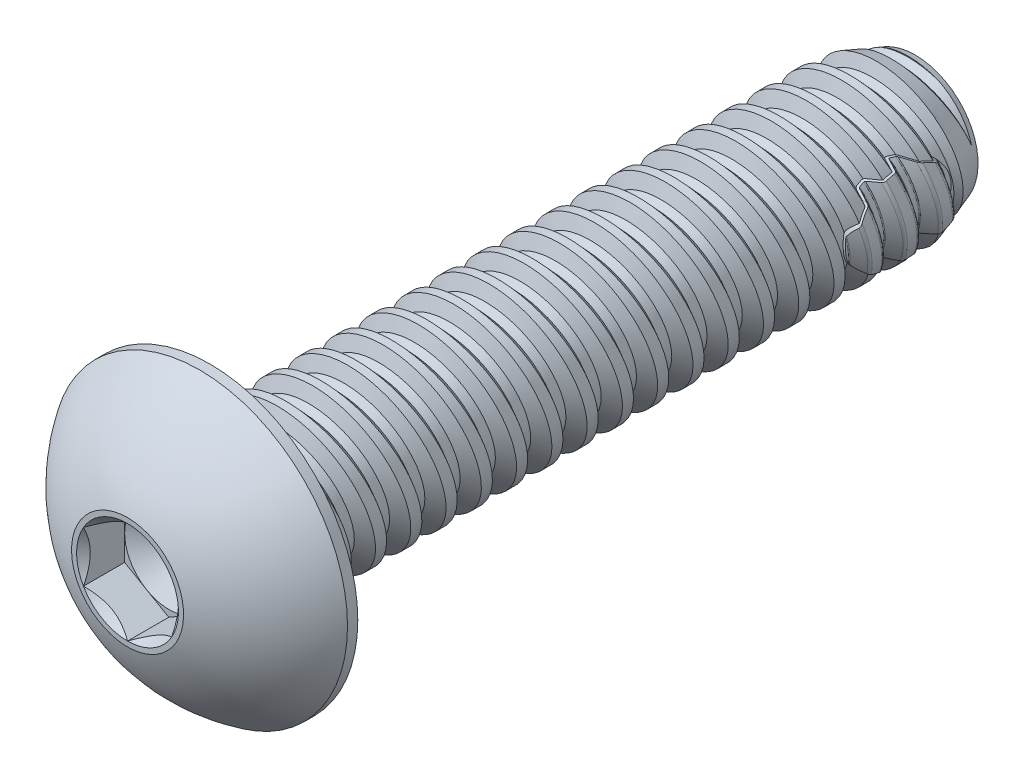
SolidWorks part; units mm, degrees
ref_plane "Front" through (0, 0, 0) normal (0, 0, 1) x (1, 0, 0)
ref_plane "Top" through (0, 0, 0) normal (0, 1, 0) x (1, 0, 0)
ref_plane "Right" through (0, 0, 0) normal (1, 0, 0) x (0, 0, -1)
sketch "Sketch1" plane through (0, 0, 0) normal (1, 0, 0) x (0, 0, -1)
  line L0 (0, 0) -> (-1.8542, 0) construction
  line L1 (0, 0) -> (15.875, 0)
  line L2 (0, 0) -> (0, 1.7526)
  line L3 (0, 1.7526) -> (15.875, 1.7526)
  line L4 (15.875, 0) -> (15.875, 1.7526)
  line L5 (0, -1.7526) -> (15.875, -1.7526) construction
  point P9 (0, 0)
  dimension "D1" = 15.875
  dimension "Thread Dia" = 3.5052
  dimension "Length" = 15.875
  dimension "Head Height" = 1.8542
revolve "Revolve1" add sketch "Sketch1" angle 360 about L0
ref_plane "Plane1" through (0, 0, 1.8542) normal (0, 0, 1) x (1, 0, 0)
sketch "Sketch2" plane through (0, 0, 0) normal (1, 0, 0) x (0, 0, -1)
  line L0 (0, 1.7526) -> (0, -1.7526) construction
  line L1 (0, -1.7526) -> (0.7938, -1.7526) construction
  line L2 (0.7938, -1.7526) -> (0, 1.7526) construction
  line L3 (0, 1.7526) -> (0.0968, 1.7745) construction
  line L4 (0.0968, 1.7745) -> (0.7741, 1.9279)
  line L5 (0.7741, 1.9279) -> (0.6271, 1.4541)
  line L6 (0.6271, 1.4541) -> (0.4336, 1.4103)
  line L7 (0.4336, 1.4103) -> (0.0968, 1.7745)
  line L8 (0.5303, 1.4322) -> (0.4355, 1.8512) construction
  line L9 (0, -1.7526) -> (15.875, -1.7526) construction
  line L10 (0, 1.7526) -> (15.875, 1.7526) construction
  line L12 (0.4578, 1.7526) -> (1.2515, -1.7526) construction
  line L13 (0, -0.1935) -> (1.7093, 0.1935) construction
  line L15 (0, 0) -> (0, 1.7526) construction
  point P19 (0.8547, 0)
  dimension "D1" = 60
  dimension "Thread Pitch" = 0.7937
  dimension "D2" = 0.0992
  dimension "D3" = 0.1984
  dimension "D4" = 0.7937
revolve "Cut-Revolve1" cut sketch "Sketch2" angle 360 about L13
sketch "Sketch3" plane through (0, 0, 0) normal (1, 0, 0) x (0, 0, -1)
  line L0 (15.875, 1.4103) -> (14.9345, 1.7526)
  line L1 (14.9345, 1.7526) -> (15.875, 1.7526)
  line L2 (15.875, 1.7526) -> (15.875, 1.4103)
  line L3 (0, 1.7526) -> (15.875, 1.7526) construction
  line L4 (15.875, 0) -> (15.875, 1.7526) construction
  line L5 (14.9345, 0) -> (0, 0) construction
  line L6 (14.9345, 1.7526) -> (14.9345, -1.7526) construction
  line L7 (0, -1.7526) -> (15.875, -1.7526) construction
  dimension "D1" = 20
  dimension "D2" = 3.5052
revolve "Cut-Revolve2" cut sketch "Sketch3" angle 360 about L5
pattern_linear "LPattern1" count 20 spacing 0.7937 along (0, 0, 1) count 2 spacing 0.7937 along (0, 0, 1)
sketch "Sketch4" plane through (0, 0, 0) normal (0, 0, 1) x (1, 0, 0)
  circle A0 centre (0, 0) radius 3.3274
  dimension "Head Dia" = 6.6548
extrude "Extrude1" add sketch "Sketch4" along normal up to surface (1.8542 mm away)
sketch "Sketch6" plane through (0, 0, 1.8542) normal (0, 0, 1) x (1, 0, 0)
  line L1 (0, -1.1457) -> (0.9922, -0.5728)
  line L2 (0.9922, -0.5728) -> (0.9922, 0.5728)
  line L3 (0.9922, 0.5728) -> (0, 1.1457)
  line L4 (0, 1.1457) -> (-0.9922, 0.5728)
  line L5 (-0.9922, 0.5728) -> (-0.9922, -0.5728)
  line L6 (-0.9922, -0.5728) -> (0, -1.1457)
  circle A0 centre (0, 0) radius 0.9922 construction
  dimension "Hex" = 1.9844
extrude "Cut-Extrude1" cut sketch "Sketch6" against normal blind 0.9271
sketch "Sketch7" plane through (0, 0, 1.8542) normal (0, 0, 1) x (1, 0, 0)
  circle A0 centre (0, 0) radius 1.1457
extrude "Cut-Extrude4" cut sketch "Sketch7" against normal blind 0.9271 draft 45
sketch "Sketch8" plane through (0, 0, 0.9271) normal (0, 0, 1) x (1, 0, 0)
  circle A0 centre (0, 0) radius 0.9922 construction
  circle A1 centre (0, 0) radius 0.9922
extrude "Cut-Extrude5" cut sketch "Sketch8" against normal blind 0.309 draft 60
sketch "Sketch13" plane through (0, 0, 0) normal (1, 0, 0) x (0, 0, -1)
  line L0 (-1.8542, -0.5728) -> (-1.8542, 0.5728) construction
  line L1 (-1.8542, 0.5728) -> (-1.8542, 1.1457) construction
  line L2 (-1.8542, -0.5728) -> (-1.8542, 0.5728) construction
  line L3 (-1.8542, 0.5728) -> (-1.8542, 1.1457) construction
  line L4 (-1.8542, -1.1457) -> (-1.8542, -0.5728) construction
  line L5 (-1.8542, -1.1457) -> (-1.8542, -0.5728) construction
  line L6 (0, -3.3274) -> (0, 3.3274) construction
  line L7 (0, -3.3274) -> (0, 3.3274) construction
  line L8 (0, 3.3274) -> (-1.8542, 3.3274) construction
  line L9 (0, 3.3274) -> (-1.8542, 3.3274) construction
  line L10 (0, 0) -> (-1.8542, 0) construction
  line L11 (0, 0) -> (-1.8542, 0) construction
  line L12 (-1.8542, 1.2602) -> (-1.8542, 3.3274)
  line L13 (-1.8542, 3.3274) -> (-0.2318, 3.3274)
  arc A0 (-0.2318, 3.3274) -> (-1.8542, 1.2602) centre (1.8796, 0) ccw
  dimension "D1" = 2.2914
  dimension "D2" = 2.5205
  dimension "D3" = 0.2318
  dimension "D4" = 1.8542
  dimension "D5" = 15.875
revolve "Cut-Revolve3" cut sketch "Sketch13" angle 360 about L11
surface "Surface-Offset1" parameters "D1"=0
fillet "Fillet2" radius 0.0762
fillet "Fillet3" radius 0.0254
thicken "Thicken2" surfaces to thicken 128 thickness 0.0508 parameters "D1"=0.0508
sketch "Sketch12" plane through (0, 0, 0) normal (1, 0, 0) x (0, 0, -1)
  line L0 (2.0654, 0.6874) -> (2.0654, -0.6874) construction
  line L1 (1.6685, 0) -> (2.4623, 0) construction
  line L2 (0.4578, 1.7526) -> (1.2515, -1.7526) construction
  arc A0 (1.2716, 0.6874) -> (2.8591, 0.6874) centre (2.0654, -0.6874) cw
  arc A1 (1.2716, 0.6874) -> (1.2716, -0.6874) centre (1.6685, 0) ccw
  arc A2 (2.8591, -0.6874) -> (2.8591, 0.6874) centre (2.4623, 0) ccw
  arc A3 (1.2716, -0.6874) -> (2.8591, -0.6874) centre (2.0654, 0.6874) ccw
  dimension "D2" = 0.7937
  dimension "D3" = 1.5875
  dimension "D1" = 0.7937
extrude "Cut-Extrude6" cut sketch "Sketch12" along normal through all flip side to cut
pattern_linear "LPattern3" count 2 spacing 11.9062 along (0, 0, 1)
delete or keep bodies "Body-Delete1" type delete bodies bodies 131
equation "\"D2@Sketch2\"=\"Thread Pitch@Sketch2\"/8"
equation "\"D3@Sketch2\"=\"Thread Pitch@Sketch2\"/4"
equation "\"D4@Sketch2\"=\"Thread Pitch@Sketch2\""
equation "\"D3@LPattern1\"=\"Thread Pitch@Sketch2\""
equation "\"D1@Cut-Extrude1\"=\"Head Height@Sketch1\"/2"
equation "\"D1@Cut-Extrude4\"=\"D1@Cut-Extrude1\""
equation "\"D1@Cut-Extrude5\"=\"D1@Cut-Extrude1\"/3"
equation "\"D1@Sketch12\"=\"Thread Pitch@Sketch2\""
equation "\"D3@Sketch12\"=\"Thread Pitch@Sketch2\"*2"
equation "\"D2@Sketch12\"=\"Thread Pitch@Sketch2\""
equation "\"D3@LPattern3\"=abs(\"Thread Pitch@Sketch2\"*(int(\"D1@Sketch1\"/\"Thread Pitch@Sketch2\")-5))"
equation "\"D1@LPattern1\"=\"D1@Sketch1\"/\"Thread Pitch@Sketch2\""
equation "\"D4@LPattern1\"=\"Thread Pitch@Sketch2\""
equation "\"D2@Sketch13\"=\"D1@Sketch13\"*1.1"
equation "\"D3@Sketch13\"=\"Head Height@Sketch1\"/8"
